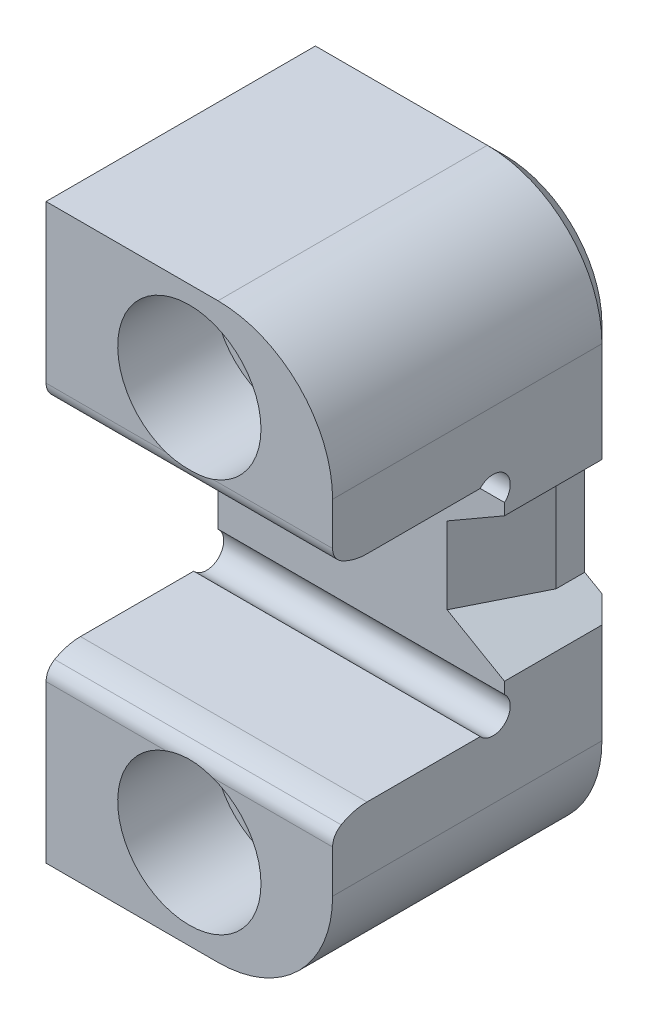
SolidWorks part; units mm, degrees
ref_plane "Front Plane" through (0, 0, 0) normal (0, 0, 1) x (1, 0, 0)
ref_plane "Top Plane" through (0, 0, 0) normal (0, 1, 0) x (1, 0, 0)
ref_plane "Right Plane" through (0, 0, 0) normal (1, 0, 0) x (0, 0, -1)
sketch "Sketch1" plane through (0, 0, 0) normal (1, 0, 0) x (0, 0, -1)
  line L0 (0, 4.7625) -> (0, 12.7)
  line L1 (0, 12.7) -> (12.7, 12.7)
  line L2 (12.7, 12.7) -> (12.7, -12.7)
  line L3 (0, 4.7625) -> (7.62, 4.7625)
  line L4 (7.62, 4.7625) -> (7.62, -4.7625)
  line L5 (-33.1352, 0) -> (32.2018, 0) construction
  line L6 (0, -12.7) -> (12.7, -12.7)
  line L7 (0, -4.7625) -> (0, -12.7)
  line L8 (0, -4.7625) -> (7.62, -4.7625)
  point P10 (12.7, 0)
  point P13 (7.62, 0)
  dimension "D1" = 25.4
  dimension "D2" = 9.525
  dimension "D3" = 12.7
  dimension "D4" = 7.62
  dimension "D5" = 5.08
extrude "Boss-Extrude1" add sketch "Sketch1" along normal mid plane 12.7
fillet "Fillet1" radius 5.08 2 edges at (6.35, -12.7, -6.35) (6.35, 12.7, -6.35)
hole_wizard "CBORE for #6 Socket Head Cap Screw1" positions "Sketch3" profile "Sketch2" counterbore size "#6" standard "ANSI Inch"
sketch "Sketch3" plane through (0, 0, 0) normal (0, 0, 1) x (1, 0, 0)
  line L0 (-1.1286, 0) -> (1.4946, 0) construction
  point P0 (0, 8.7312)
  point P8 (0, -8.7312)
  dimension "D1" = 17.4625
sketch "Sketch2" plane through (0, 8.7312, 0) normal (1, 0, 0) x (0, -1, 0)
  line L0 (0, 0) -> (0, 12.7)
  line L1 (0, 12.7) -> (2.1526, 12.7)
  line L3 (2.1526, 12.7) -> (2.1526, 4.2672)
  line L4 (2.1526, 4.2672) -> (3.175, 4.2672)
  line L5 (3.175, 4.2672) -> (3.175, 0)
  line L7 (3.175, 0) -> (0, 0)
  line L11 (0, -6.35) -> (0, 107.95) construction
  dimension "Thru Hole Dia." = 4.3053
  dimension "Thru Hole Depth" = 12.7
  dimension "C'Bore Dia." = 6.35
  dimension "C'Bore Depth" = 4.2672
chamfer "Chamfer1" distance 0.762 angle 45 5 edges at (-2.54, -12.7, -12.7) (4.8621, -11.2121, -12.7) (6.35, 0, -12.7) (4.8621, 11.2121, -12.7) (-2.54, 12.7, -12.7)
sketch "Sketch4" plane through (0, 0, 0) normal (1, 0, 0) x (0, 0, -1)
  line L0 (0, 5.7287) -> (0, 4.7625)
  line L1 (0, 7.62) -> (0, 4.7625) construction
  line L2 (0, 4.7625) -> (1.524, 4.7625)
  line L3 (0, 4.7625) -> (7.62, 4.7625) construction
  line L4 (0, 0) -> (3.587, 0) construction
  line L5 (0, -4.7625) -> (1.524, -4.7625)
  line L6 (0, -5.7287) -> (0, -4.7625)
  arc A0 (1.524, 4.7625) -> (0.381, 5.0688) centre (1.524, 7.0485) cw
  arc A1 (0.381, 5.0688) -> (0, 5.7287) centre (0.762, 5.7287) cw
  arc A2 (0.381, -5.0688) -> (0, -5.7287) centre (0.762, -5.7287) ccw
  arc A3 (1.524, -4.7625) -> (0.381, -5.0688) centre (1.524, -7.0485) ccw
  dimension "D2" = 0.762
  dimension "D3" = 2.286
  dimension "D1" = 1.524
extrude "Cut-Extrude1" cut sketch "Sketch4" against normal through all and the other way through all
sketch "Sketch5" plane through (6.35, 0, 0) normal (1, 0, 0) x (0, 0, -1)
  line L0 (1.524, 4.7625) -> (7.62, 4.7625) construction
  line L1 (7.62, 4.7625) -> (7.62, -4.7625) construction
  line L2 (3.0751, 0) -> (9.0481, 0) construction
  circle A0 centre (7.112, 4.2545) radius 0.762
  circle A1 centre (7.112, -4.2545) radius 0.762
  dimension "D1" = 1.524
  dimension "D2" = 0.508
  dimension "D3" = 0.508
extrude "Cut-Extrude2" cut sketch "Sketch5" against normal through all
sketch "Sketch7" plane through (0, 0, -12.7) normal (0, 0, -1) x (-1, 0, 0)
  line L0 (-6.35, 3.175) -> (-4.826, 2.2951)
  line L1 (-6.35, -7.62) -> (-6.35, 7.62) construction
  line L2 (-4.826, 2.2951) -> (-4.826, -2.2951)
  line L3 (-7.3579, 0) -> (0.7869, 0) construction
  line L4 (-6.35, -3.175) -> (-4.826, -2.2951)
  point P9 (-4.826, 0)
  dimension "D1" = 1.524
  dimension "D2" = 6.35
  dimension "D3" = 60
extrude "Cut-Extrude4" cut sketch "Sketch7" against normal through all and the other way through all
chamfer "Chamfer4" distance 3.81 angle 15 1 edges at (4.826, 0, -7.62)
